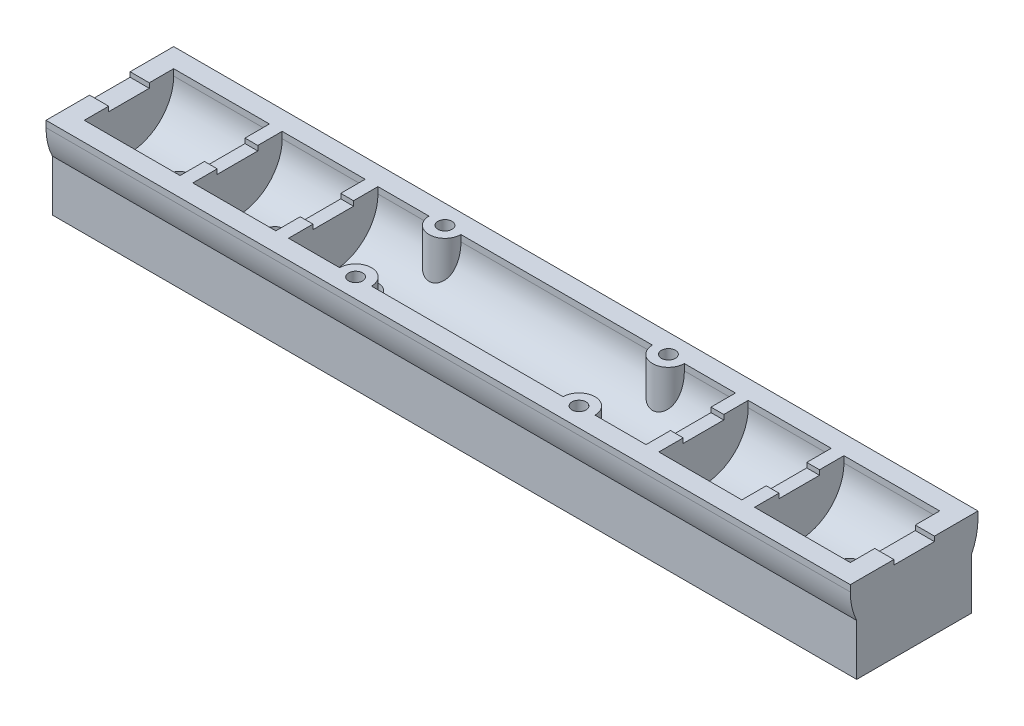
SolidWorks part; units mm, degrees
ref_plane "Front Plane" through (0, 0, 0) normal (0, 0, 1) x (1, 0, 0)
ref_plane "Top Plane" through (0, 0, 0) normal (0, 1, 0) x (1, 0, 0)
ref_plane "Right Plane" through (0, 0, 0) normal (1, 0, 0) x (0, 0, -1)
ref_plane "Plane1" through (60, 0, 0) normal (1, 0, 0) x (0, 0, -1)
sketch "Sketch1" plane through (0, 0, 0) normal (1, 0, 0) x (0, 0, -1)
  line L0 (-10, 0) -> (10, 0) construction
  line L1 (-10, 0) -> (-7, 0)
  line L2 (0, 0) -> (0, -10) construction
  line L3 (10, 0) -> (7, 0)
  line L4 (10, 0) -> (7, 0)
  line L5 (9, -4.3589) -> (9, -12.3589)
  line L6 (9, -12.3589) -> (-9, -12.3589)
  line L7 (-9, -12.3589) -> (-9, -4.3589)
  arc A0 (-10, 0) -> (10, 0) centre (0, 0) ccw
  arc A1 (-7, 0) -> (7, 0) centre (0, 0) ccw
  arc A2 (9, -4.3589) -> (-9, -4.3589) centre (0, 0) cw
  dimension "D1" = 10
  dimension "D2" = 3
  dimension "D3" = 18
  dimension "D4" = 8
extrude "Boss-Extrude1" add sketch "Sketch1" along normal blind 120 contours A1 L1 A0 L3 | A0 L7 L6 L5
sketch "Sketch2" plane through (120, 0, 0) normal (1, 0, 0) x (0, 0, -1)
  line L0 (-10, 0) -> (10, 0)
  line L1 (10, 0) -> (7, 0) construction
  line L2 (-9, -4.3589) -> (-9, -12.3589)
  line L3 (-9, -12.3589) -> (9, -12.3589)
  line L4 (9, -12.3589) -> (9, -4.3589)
  arc A0 (-10, 0) -> (-9, -4.3589) centre (0, 0) ccw construction
  arc A1 (-10, 0) -> (10, 0) centre (0, 0) ccw
  arc A2 (-9, -4.3589) -> (9, -4.3589) centre (0, 0) ccw
extrude "Boss-Extrude3" add sketch "Sketch2" along normal blind 3 contours A1 M7 M8 M9 | A1 M3 M10 M4 M1 M2 | L0 M1
mirror "Mirror1" about plane through (60, 0, 0) normal (1, 0, 0) of "Boss-Extrude3"
sketch "Sketch4" plane through (0, 0, 0) normal (0, 1, 0) x (1, 0, 0)
  line L0 (-3, 10) -> (-3, -10)
  line L1 (-3, -10) -> (123, -10)
  line L2 (123, -10) -> (123, 10)
  line L3 (123, 10) -> (-3, 10)
  line L4 (0, 7) -> (0, -7)
  line L5 (0, -7) -> (120, -7)
  line L6 (120, 7) -> (120, -7) construction
  line L7 (120, -7) -> (0, -7) construction
  line L8 (120, -7) -> (120, 7)
  line L9 (120, 7) -> (0, 7)
extrude "Boss-Extrude4" add sketch "Sketch4" along normal blind 1
ref_plane "Plane2" through (15, 0, 0) normal (1, 0, 0) x (0, 0, -1)
sketch "Sketch6" plane through (15, 0, 0) normal (1, 0, 0) x (0, 0, -1)
  line L0 (9, 1) -> (-9, 1) construction
  line L1 (10, 1) -> (-10, 1) construction
  line L2 (9, 1) -> (9, 0)
  line L3 (-9, 1) -> (-9, 0)
  line L4 (0, 1) -> (0, -9) construction
  line L5 (3.175, 1) -> (3.175, 0.25)
  line L6 (-3.175, 1) -> (-3.175, 0.25)
  line L7 (9, 1) -> (3.175, 1)
  line L8 (-3.175, 1) -> (-9, 1)
  line L9 (-3.175, 0.25) -> (3.175, 0.25)
  arc A0 (9, 0) -> (-9, 0) centre (0, 0) cw
  dimension "D1" = 1
  dimension "D2" = 1
  dimension "D3" = 1
  dimension "D4" = 6.35
  dimension "D5" = 0.75
sketch "Sketch7" plane through (0, -12.3589, 0) normal (0, -1, 0) x (1, 0, 0)
  line L0 (123, 0) -> (-3, 0) construction
  line L1 (123, 9) -> (123, -9) construction
  line L2 (-3, 9) -> (-3, -9) construction
  circle A0 centre (112.5, 0) radius 1.7
  point P6 (112.5, 0)
  dimension "D2" = 3.4
  dimension "D1" = 10.5
extrude "Cut-Extrude3" cut sketch "Sketch7" against normal through all
pattern_linear "LPattern2" count 2 spacing 15 along (-1, 0, 0) of "Cut-Extrude3"
sketch "Sketch8" plane through (0, -12.3589, 0) normal (0, -1, 0) x (1, 0, 0)
  line L0 (-3, 0) -> (123, 0) construction
  line L1 (-3, 9) -> (-3, -9) construction
  line L2 (123, 9) -> (123, -9) construction
  circle A0 centre (7.5, 0) radius 1.7
  point P6 (7.5, 0)
  dimension "D2" = 3.4
  dimension "D1" = 10.5
extrude "Cut-Extrude4" cut sketch "Sketch8" against normal through all
pattern_linear "LPattern3" count 3 spacing 15 along (1, 0, 0) of "Cut-Extrude4"
extrude "Boss-Extrude5" add sketch "Sketch6" along normal blind 2
pattern_linear "LPattern4" count 2 spacing 15 along (1, 0, 0) of "Boss-Extrude5"
mirror "Mirror2" about plane through (60, 0, 0) normal (1, 0, 0) of "LPattern4", "Boss-Extrude5"
sketch "Sketch9" plane through (-3, 0, 0) normal (-1, 0, 0) x (0, 0, 1)
  line L1 (-3.175, 1) -> (3.175, 1)
  line L2 (-3.175, 1) -> (-3.175, 0.25)
  line L3 (-3.175, 0.25) -> (3.175, 0.25)
  line L4 (3.175, 1) -> (3.175, 0.25)
  line L5 (0, 0.25) -> (0, 1) construction
  line L6 (-10, 1) -> (10, 1) construction
  dimension "D1" = 0.75
  dimension "D2" = 6.35
extrude "Cut-Extrude5" cut sketch "Sketch9" against normal up to next
mirror "Mirror3" about plane through (60, 0, 0) normal (1, 0, 0) of "Cut-Extrude5"
sketch "Sketch10" plane through (0, 1, 0) normal (0, 1, 0) x (1, 0, 0)
  line L0 (32, -7) -> (88, -7) construction
  line L1 (45, -7) -> (40, -7)
  arc A0 (40, -7) -> (45, -7) centre (42.5, -7) cw
  dimension "D1" = 2.5
  dimension "D2" = 10.5
extrude "Boss-Extrude6" add sketch "Sketch10" against normal up to surface (1 mm away)
sketch "Sketch11" plane through (0, 1, 0) normal (0, 1, 0) x (1, 0, 0)
  circle A0 centre (42.5, -7) radius 1.1
  dimension "D1" = 2.2
extrude "Cut-Extrude6" cut sketch "Sketch11" against normal blind 1.7
mirror "Mirror4" about plane through (0, 0, 0) normal (0, 0, 1) of "Cut-Extrude6", "Boss-Extrude6"
pattern_linear "LPattern5" count 2 spacing 35 along (1, 0, 0) of "Mirror4", "Boss-Extrude6", "Cut-Extrude6"
